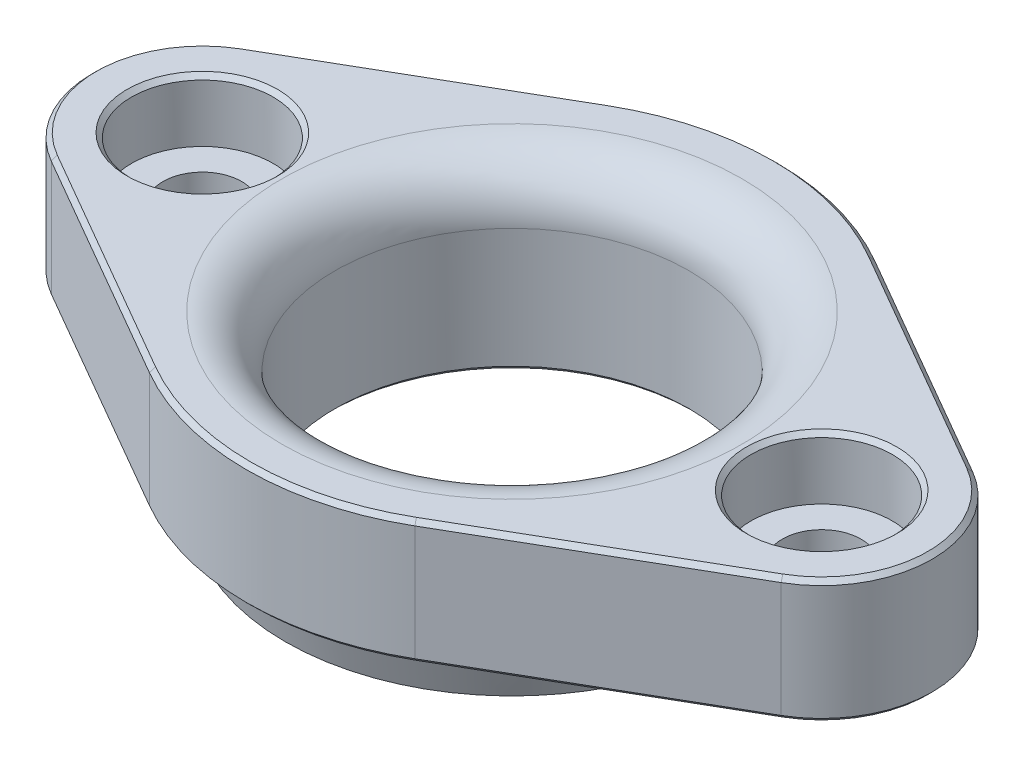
SolidWorks part; units mm, degrees
ref_plane "Front Plane" through (0, 0, 0) normal (0, 0, 1) x (1, 0, 0)
ref_plane "Top Plane" through (0, 0, 0) normal (0, 1, 0) x (1, 0, 0)
ref_plane "Right Plane" through (0, 0, 0) normal (1, 0, 0) x (0, 0, -1)
sketch "Sketch1" plane through (0, 0, 0) normal (0, 0, 1) x (1, 0, 0)
  line L0 (0, 0) -> (0, 37.9055) construction
  line L1 (-5.08, 0) -> (-5.08, 5.08)
  line L2 (-5.08, 5.08) -> (-12.065, 5.08)
  line L3 (-12.065, 5.08) -> (-12.065, 1.524)
  line L4 (-12.065, 1.524) -> (-6.8854, 1.524)
  line L5 (-6.8854, 1.524) -> (-6.477, 0)
  line L6 (-6.477, 0) -> (-5.08, 0)
  dimension "D1" = 10.16
  dimension "D2" = 1.524
  dimension "D3" = 12.954
  dimension "D4" = 5.08
  dimension "D5" = 24.13
  dimension "D6" = 15
revolve "Revolve1" add sketch "Sketch1" angle 360 about L0
fillet "Fillet1" radius 0.508 1 edges at (0, 1.524, -6.8854)
fillet "Fillet2" radius 1.524 1 edges at (0, 5.08, -5.08)
hole_wizard "CBORE for #2 Socket Head Cap Screw1" positions "Sketch4" profile "Sketch3" counterbore size "#2" standard "ANSI Inch"
sketch "Sketch4" plane through (0, 5.08, 0) normal (0, 1, 0) x (1, 0, 0)
  line L0 (-8.89, 0) -> (0, 0) construction
  circle A0 centre (0, 0) radius 8.89 construction
  point P0 (-8.89, 0)
  dimension "D1" = 17.78
sketch "Sketch3" plane through (-8.89, 5.08, 0) normal (1, 0, 0) x (0, 0, 1)
  line L0 (0, 0) -> (0, 5.08)
  line L1 (0, 5.08) -> (1.1303, 5.08)
  line L3 (1.1303, 5.08) -> (1.1303, 1.778)
  line L4 (1.1303, 1.778) -> (2.032, 1.778)
  line L5 (2.032, 1.778) -> (2.032, 0)
  line L7 (2.032, 0) -> (0, 0)
  line L11 (0, -6.35) -> (0, 107.95) construction
  dimension "Thru Hole Dia." = 2.2606
  dimension "Thru Hole Depth" = 5.08
  dimension "C'Bore Dia." = 4.064
  dimension "C'Bore Depth" = 1.778
pattern_circular "CirPattern1" count 2 over 360 about axis through (0, 0, 0) along (0, 1, 0) of "CBORE for #2 Socket Head Cap Screw1"
sketch "Sketch5" plane through (0, 5.08, 0) normal (0, 1, 0) x (1, 0, 0)
  line L0 (-10.4775, -2.7496) -> (-3.81, -6.5991)
  line L1 (-10.4775, 2.7496) -> (-3.81, 6.5991)
  line L2 (3.81, -6.5991) -> (10.4775, -2.7496)
  line L3 (10.4775, 2.7496) -> (3.81, 6.5991)
  arc A0 (-10.4775, 2.7496) -> (-10.4775, -2.7496) centre (-8.89, 0) ccw
  circle A1 centre (0, 0) radius 12.065 construction
  arc A2 (10.4775, -2.7496) -> (10.4775, 2.7496) centre (8.89, 0) ccw
  arc A3 (-3.81, -6.5991) -> (3.81, -6.5991) centre (0, 0) ccw
  arc A4 (3.81, 6.5991) -> (-3.81, 6.5991) centre (0, 0) ccw
  dimension "D1" = 7.62
extrude "Cut-Extrude1" cut sketch "Sketch5" against normal through all flip side to cut
chamfer "Chamfer1" distance 0.127 angle 45 22 edges at (7.1437, 5.08, 4.6744) (12.065, 5.08, 0) (-12.065, 5.08, 0) (-8.89, 5.08, 2.032) (8.89, 5.08, 2.032) (12.065, 1.524, 0) (-12.065, 1.524, 0) (7.1437, 1.524, 4.6744) (8.89, 1.524, 1.1303) (-8.89, 1.524, 1.1303) (0, 0, -6.477) (0, 0, -5.08) (-7.1437, 1.524, -4.6744) (-7.1437, 1.524, 4.6744) (7.1437, 1.524, -4.6744) (0, 5.08, 7.62) (-7.1437, 5.08, 4.6744) (-7.1437, 5.08, -4.6744) (0, 5.08, -7.62) (7.1437, 5.08, -4.6744) (0, 1.524, -7.62) (0, 1.524, 7.62)
